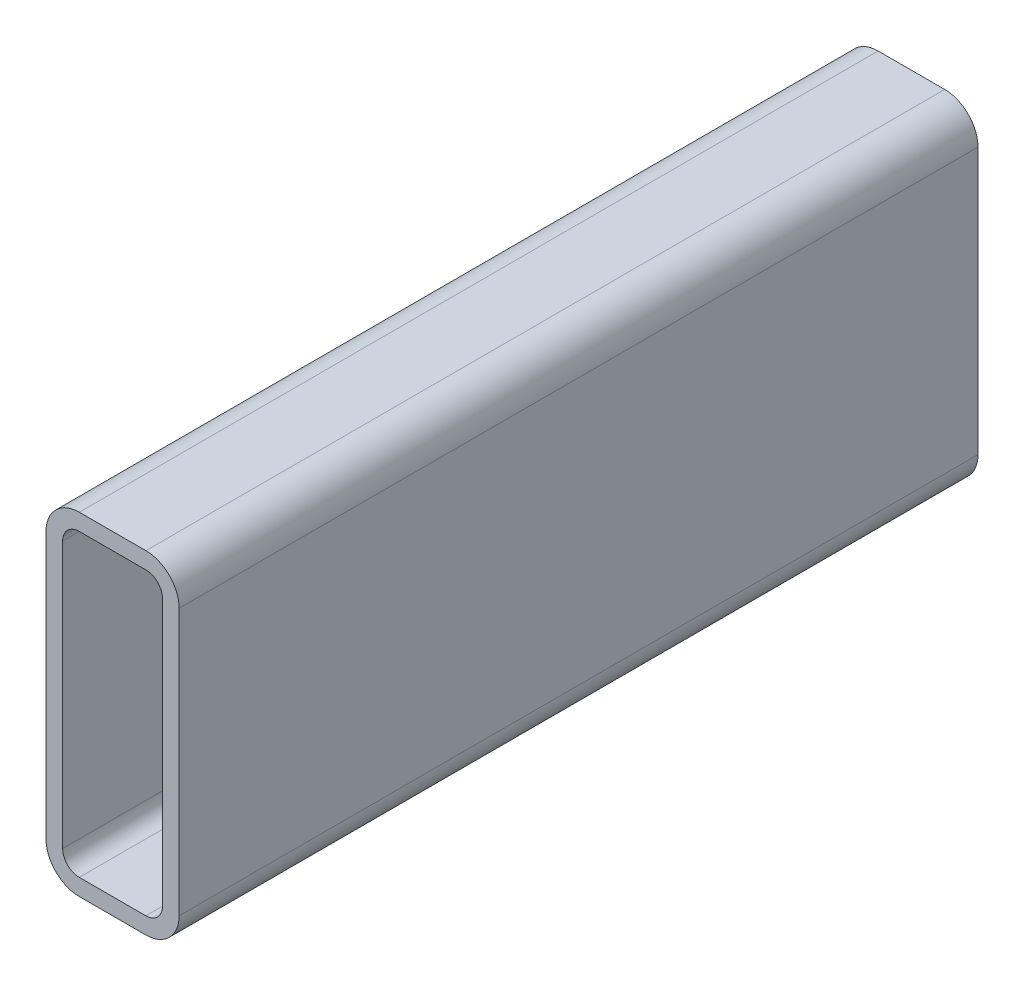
SolidWorks part; units mm, degrees
ref_plane "Front Plane" through (0, 0, 0) normal (0, 0, 1) x (1, 0, 0)
ref_plane "Top Plane" through (0, 0, 0) normal (0, 1, 0) x (1, 0, 0)
ref_plane "Right Plane" through (0, 0, 0) normal (1, 0, 0) x (0, 0, -1)
sketch "Sketch1" plane through (0, 0, 0) normal (0, 0, 1) x (1, 0, 0)
  line B0 (12.7, 127) -> (38.1, 127)
  arc B1 (50.8, 114.3) -> (38.1, 127) centre (38.1, 114.3) ccw
  line B2 (50.8, 114.3) -> (50.8, 12.7)
  arc B3 (38.1, 0) -> (50.8, 12.7) centre (38.1, 12.7) ccw
  line B4 (38.1, 0) -> (12.7, 0)
  arc B5 (0, 12.7) -> (12.7, 0) centre (12.7, 12.7) ccw
  line B6 (0, 12.7) -> (0, 114.3)
  arc B7 (12.7, 127) -> (0, 114.3) centre (12.7, 114.3) ccw
  line B8 (12.7, 120.65) -> (38.1, 120.65)
  arc B9 (44.45, 114.3) -> (38.1, 120.65) centre (38.1, 114.3) ccw
  line B10 (44.45, 114.3) -> (44.45, 12.7)
  arc B11 (38.1, 6.35) -> (44.45, 12.7) centre (38.1, 12.7) ccw
  line B12 (38.1, 6.35) -> (12.7, 6.35)
  arc B13 (6.35, 12.7) -> (12.7, 6.35) centre (12.7, 12.7) ccw
  line B14 (6.35, 12.7) -> (6.35, 114.3)
  arc B15 (12.7, 120.65) -> (6.35, 114.3) centre (12.7, 114.3) ccw
sketch_block_instance "HSS5x2x0.250-1"
sketch_block "HSS5x2x0.250"
extrude "Boss-Extrude1" add sketch "Sketch1" along normal blind 304.8
